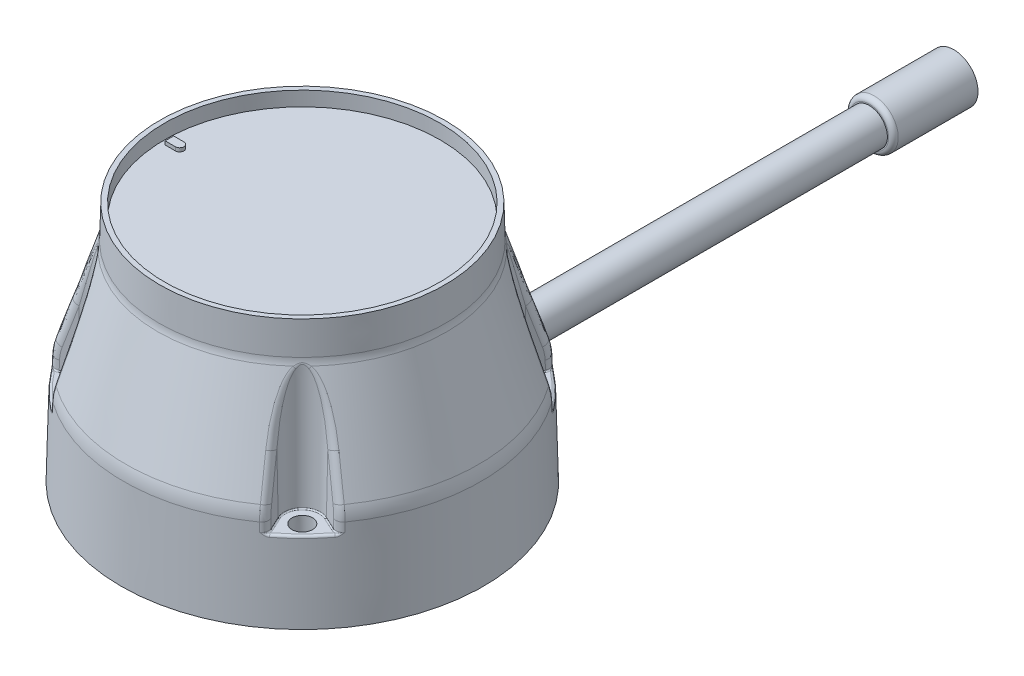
SolidWorks part; units mm, degrees
ref_plane "前视基准面" through (0, 0, 0) normal (0, 0, 1) x (1, 0, 0)
ref_plane "上视基准面" through (0, 0, 0) normal (0, 1, 0) x (1, 0, 0)
ref_plane "右视基准面" through (0, 0, 0) normal (1, 0, 0) x (0, 0, -1)
imported_body "GBT-C5A-100.01-0200_defeature-1-solid1"
imported_body "GBT-C5A-100.09-0100-1-solid1"
imported_body "C5A底座线缆-1-solid1"
ref_plane "基准面1" [suppressed] through (0, 0, -234.5789) normal (0, 0, 1) x (1, 0, 0)
split "分割1" trim tools "基准面1" bodies to split 108 resulting bodies 109 110
